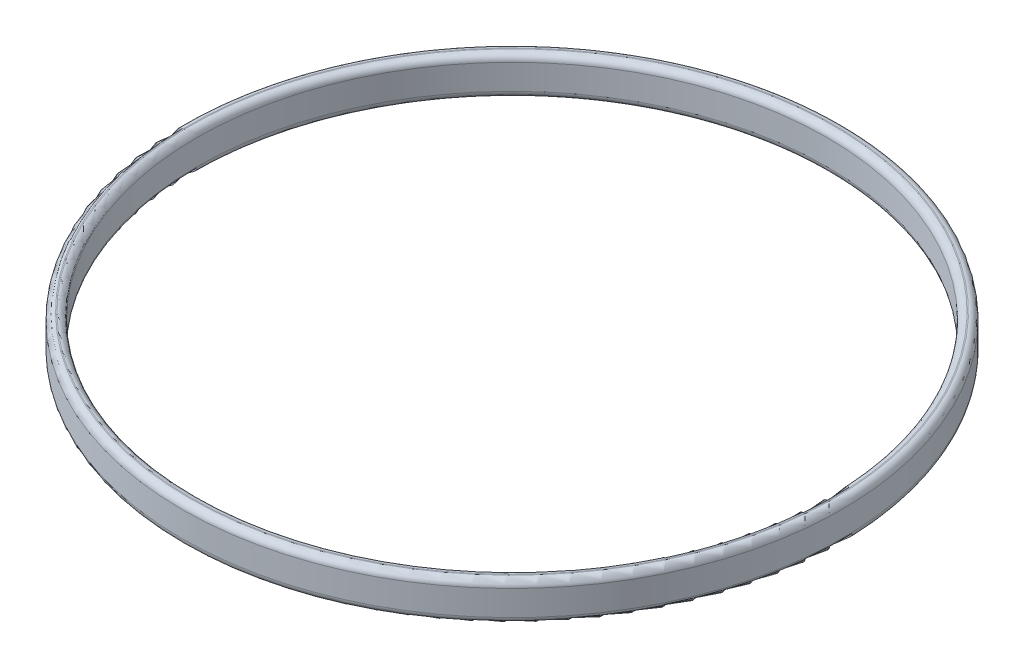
SolidWorks part; units mm, degrees
ref_plane "Plane1" through (0, 0, 0) normal (0, 0, 1) x (1, 0, 0)
ref_plane "Plane2" through (0, 0, 0) normal (0, 1, 0) x (1, 0, 0)
ref_plane "Plane3" through (0, 0, 0) normal (1, 0, 0) x (0, 0, -1)
sketch "Sketch1" plane through (0, 0, 0) normal (0, 0, 1) x (1, 0, 0)
  line L0 (0, 14.7091) -> (0, -23.1856) construction
  line L1 (-73.047, 0) -> (90.7478, 0) construction
  line L3 (42.164, 2.54) -> (42.291, 2.54)
  line L4 (41.275, 1.651) -> (41.275, -1.651)
  line L5 (42.164, -2.54) -> (42.291, -2.54)
  line L6 (43.18, 1.651) -> (43.18, -1.651)
  arc A0 (41.275, 1.651) -> (42.164, 2.54) centre (42.164, 1.651) cw
  arc A1 (43.18, 1.651) -> (42.291, 2.54) centre (42.291, 1.651) ccw
  arc A2 (42.164, -2.54) -> (41.275, -1.651) centre (42.164, -1.651) cw
  arc A3 (43.18, -1.651) -> (42.291, -2.54) centre (42.291, -1.651) cw
  dimension "D4" = 0.889
  dimension "D1" = 82.55
  dimension "D2" = 86.36
  dimension "D3" = 5.08
revolve "Base-Revolve" add sketch "Sketch1" angle 360 about L0
